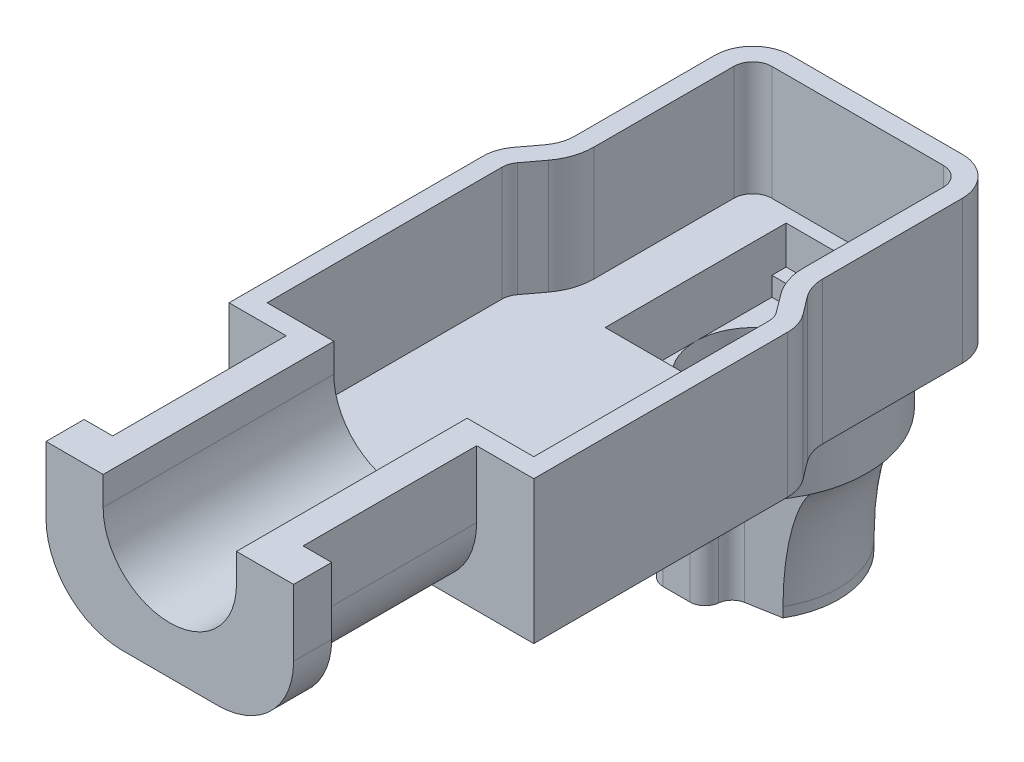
SolidWorks part; units mm, degrees
ref_plane "Front Plane" through (0, 0, 0) normal (0, 0, 1) x (1, 0, 0)
ref_plane "Top Plane" through (0, 0, 0) normal (0, 1, 0) x (1, 0, 0)
ref_plane "Right Plane" through (0, 0, 0) normal (1, 0, 0) x (0, 0, -1)
sketch "Sketch1" plane through (0, 0, 0) normal (0, 1, 0) x (-1, 0, 0)
  line L0 (-1.875, 8.0563) -> (-1.875, 12.7) construction
  line L1 (-1.875, 12.7) -> (1.875, 12.7) construction
  line L2 (1.875, 12.7) -> (1.875, 8.0563) construction
  line L3 (-6.25, 1.7379) -> (-6.25, -0.55) construction
  line L4 (6.25, 1.7379) -> (6.25, -0.55) construction
  line L5 (5, -1.8) -> (3.85, -1.8) construction
  line L6 (3.85, -1.8) -> (1.1627, -1.3232) construction
  line L7 (0.75, -0.8309) -> (0.75, -0.6) construction
  line L8 (0.75, -0.6) -> (-0.75, -0.6) construction
  line L9 (-0.75, -0.6) -> (-0.75, -0.8309) construction
  line L10 (-1.1627, -1.3232) -> (-3.85, -1.8) construction
  line L11 (-3.85, -1.8) -> (-5, -1.8) construction
  line L12 (0, -0.6) -> (0, -6.35) construction
  line L13 (-6.35, 0) -> (6.35, 0) construction
  line L14 (0, -6.35) -> (0, 12.7) construction
  arc A0 (6.25, 1.7379) -> (2.1991, 7.5882) centre (0, 1.7379) ccw construction
  arc A1 (-6.25, 1.7379) -> (-2.1991, 7.5882) centre (0, 1.7379) cw construction
  arc A4 (6.25, -0.55) -> (5, -1.8) centre (5, -0.55) cw construction
  arc A5 (-6.25, -0.55) -> (-5, -1.8) centre (-5, -0.55) ccw construction
  arc A6 (1.1627, -1.3232) -> (0.75, -0.8309) centre (1.25, -0.8309) cw construction
  arc A7 (-0.75, -0.8309) -> (-1.1627, -1.3232) centre (-1.25, -0.8309) cw construction
  arc A8 (1.875, 8.0563) -> (2.1991, 7.5882) centre (2.375, 8.0563) ccw construction
  arc A9 (-2.1991, 7.5882) -> (-1.875, 8.0563) centre (-2.375, 8.0563) ccw construction
  circle A10 centre (0, 0) radius 4.25 construction
  point P16 (0, -0.6)
  point P17 (0, 12.7)
  point P34 (0.75, -1.25)
  point P39 (1.875, 7.7)
  dimension "D9" = 1.25
  dimension "D10" = 1.1627
  dimension "D11" = 0.5
  dimension "D13" = 8.5
  dimension "D1" = 3.75
  dimension "D2" = 12.5
  dimension "D3" = 14.5
  dimension "D4" = 5.75
  dimension "D5" = 1.5
  dimension "D6" = 19.05
  dimension "D7" = 5
  dimension "D8" = 0.65
  dimension "D12" = 0.6
sketch "Sketch2" plane through (0, 0, 0) normal (0, 1, 0) x (1, 0, 0)
  line L0 (-0.75, 0.6) -> (0.75, 0.6)
  line L1 (0.75, 0.6) -> (0.75, 0.9147)
  line L2 (1.0801, 1.3086) -> (1.937, 1.4606)
  line L3 (-1.937, 1.4606) -> (-1.0801, 1.3086)
  line L4 (-0.75, 0.9147) -> (-0.75, 0.6)
  line L5 (1.1627, 1.3232) -> (3.85, 1.8) construction
  line L6 (-3.85, 1.8) -> (-1.1627, 1.3232) construction
  line L7 (2.0813, 2.2069) -> (-12840.1019, -8733.3974) construction
  line L8 (2.0783, 2.2049) -> (-12840.1049, -8733.3994) construction
  line L9 (1.7853, 2.0056) -> (-12840.3979, -8733.5987) construction
  line L10 (-4.8081, -2.6544) -> (12753.8291, 8676.1196) construction
  line L11 (0.8437, 1.3651) -> (0.925, 1.2455) construction
  line L12 (-1.593, 4.25) -> (1.593, 4.25) construction
  line L13 (0, 0.6) -> (0, 6.35) construction
  line L14 (-1.9625, 4.1053) -> (1.9625, 4.1053) construction
  line L15 (0, 4.25) -> (0, 4.1053) construction
  circle A1 centre (0, 2.6053) radius 1.5
  arc A2 (-1.0801, 1.3086) -> (-0.75, 0.9147) centre (-1.15, 0.9147) cw
  arc A3 (0.75, 0.9147) -> (1.0801, 1.3086) centre (1.15, 0.9147) cw
  arc A4 (-1.937, 1.4606) -> (1.937, 1.4606) centre (0, 2.6053) cw
  circle A5 centre (0, 0) radius 4.25 construction
  point P26 (-0.75, 1.25)
  dimension "D1" = 3
  dimension "D2" = 0.4
  dimension "D3" = 2.25
extrude "Boss-Extrude1" add sketch "Sketch2" along normal blind 3.25
sketch "Sketch4" plane through (0, 3.25, 0) normal (0, 1, 0) x (1, 0, 0)
  line L1 (-1.5, 0.6053) -> (1.5, 0.6053) construction
  line L2 (-1.5, 0.6053) -> (-1.5, 4.6053) construction
  line L3 (-1.5, 4.6053) -> (1.5, 4.6053) construction
  line L4 (1.5, 0.6053) -> (1.5, 4.6053) construction
  line L5 (-1.5, 0.6053) -> (1.5, 4.6053) construction
  line L6 (-1.5, 4.6053) -> (1.5, 0.6053) construction
  circle A0 centre (0, 2.6053) radius 1.5
  circle A1 centre (0, 2.6053) radius 3
  circle A2 centre (0, 2.6053) radius 1.5 construction
  dimension "D1" = 6
  dimension "D2" = 3
  dimension "D3" = 4
extrude "Boss-Extrude2" add sketch "Sketch4" along normal blind 0.75
sketch "Sketch3" plane through (0, 4, 0) normal (0, 1, 0) x (1, 0, 0)
  line L0 (1.5, 4.6053) -> (-1.5, 0.6053) construction
  line L1 (-1.5, 0.6053) -> (1.5, 0.6053)
  line L2 (-1.5, 0.6053) -> (-1.5, 4.6053)
  line L3 (-1.5, 4.6053) -> (1.5, 4.6053)
  line L4 (1.5, 0.6053) -> (1.5, 4.6053)
  line L5 (-1.5, 4.6053) -> (1.5, 0.6053) construction
  circle A1 centre (0, 2.6053) radius 3
  circle A2 centre (0, 2.6053) radius 3 construction
  point P4 (0, 2.6053)
  dimension "D1" = 4
  dimension "D2" = 3
extrude "Boss-Extrude3" add sketch "Sketch3" along normal blind 1.5
sketch "Sketch5" plane through (0, 5.5, 0) normal (0, 1, 0) x (1, 0, 0)
  line L0 (1.5, 0.6053) -> (1.5, 4.6053) construction
  line L1 (-1.5, 0.2303) -> (1.5, 0.2303)
  line L2 (-1.5, 0.2303) -> (-1.5, 4.9803)
  line L3 (-1.5, 4.9803) -> (1.5, 4.9803)
  line L4 (1.5, 0.2303) -> (1.5, 4.9803)
  line L5 (-1.5, 0.2303) -> (1.5, 4.9803) construction
  line L6 (-1.5, 4.9803) -> (1.5, 0.2303) construction
  point P0 (0, 2.6053)
  dimension "D1" = 4.75
extrude "Cut-Extrude1" cut sketch "Sketch5" against normal offset from surface (1 mm away) 0.5
sketch "Sketch6" plane through (0, 5.5, 0) normal (0, 1, 0) x (1, 0, 0)
  line L0 (-3.25, 5.8553) -> (3.25, 5.8553)
  line L1 (3.25, 5.8553) -> (3.25, 0.8553)
  line L2 (3.25, 0.8553) -> (4, -0.1447)
  line L3 (4, -0.1447) -> (4, -6.6447)
  line L4 (4, -6.6447) -> (-4, -6.6447)
  line L5 (-4, -6.6447) -> (-4, -0.1447)
  line L6 (-4, -0.1447) -> (-3.25, 0.8553)
  line L7 (-3.25, 0.8553) -> (-3.25, 5.8553)
  line L8 (-3.25, 0.8553) -> (3.25, 0.8553) construction
  line L9 (-4, -0.1447) -> (4, -0.1447) construction
  line L10 (0, 5.8553) -> (0, -6.6447) construction
  line L11 (0, 0.6) -> (0, 6.35) construction
  line L12 (-3.25, 2.6053) -> (3.25, 2.6053) construction
  circle A0 centre (0, 2.6053) radius 3 construction
  circle A1 centre (0, 2.6053) radius 3
  point P13 (0, 0.8553)
  point P15 (0, -0.1447)
  dimension "D1" = 8
  dimension "D2" = 6.5
  dimension "D3" = 5
  dimension "D4" = 6.5
  dimension "D5" = 1
  dimension "D6" = 3.25
extrude "Boss-Extrude5" add sketch "Sketch6" against normal blind 0.75
fillet "Fillet1" radius 1 6 edges at (4, 5.125, 0.1447) (3.25, 5.125, -0.8553) (-4, 5.125, 0.1447) (-3.25, 5.125, -0.8553) (3.25, 5.125, -5.8553) (-3.25, 5.125, -5.8553)
sketch "Sketch7" plane through (0, 5.5, 0) normal (0, 1, 0) x (1, 0, 0)
  line L52 (-4, -6.6447) -> (-4, -0.478)
  line L53 (-3.8, 0.122) -> (-3.45, 0.5887)
  line L54 (-3.25, 1.1887) -> (-3.25, 4.8553)
  line L55 (-2.25, 5.8553) -> (2.25, 5.8553)
  line L56 (3.25, 4.8553) -> (3.25, 1.1887)
  line L57 (3.45, 0.5887) -> (3.8, 0.122)
  line L58 (4, -0.478) -> (4, -6.6447)
  line L59 (2.75, 1.1887) -> (2.75, 4.8553)
  line L60 (3.4, -0.178) -> (3.05, 0.2887)
  line L61 (3.5, -6.6447) -> (3.5, -0.478)
  line L62 (-3.5, -0.478) -> (-3.5, -6.6447)
  line L63 (-3.05, 0.2887) -> (-3.4, -0.178)
  line L64 (-2.75, 4.8553) -> (-2.75, 1.1887)
  line L65 (2.25, 5.3553) -> (-2.25, 5.3553)
  line L66 (2.75, 1.1887) -> (2.75, 4.8553)
  line L67 (3.4, -0.178) -> (3.05, 0.2887)
  line L68 (3.5, -6.6447) -> (3.5, -0.478)
  line L69 (-3.5, -0.478) -> (-3.5, -6.6447)
  line L70 (-3.05, 0.2887) -> (-3.4, -0.178)
  line L71 (-2.75, 4.8553) -> (-2.75, 1.1887)
  line L72 (2.25, 5.3553) -> (-2.25, 5.3553)
  line L73 (4, -6.6447) -> (3.5, -6.6447)
  line L74 (-4, -6.6447) -> (-3.5, -6.6447)
  line L75 (3.8, 0.122) -> (3.45, 0.5887) construction
  line L76 (3.25, 1.1887) -> (3.25, 4.8553) construction
  line L77 (2.25, 5.8553) -> (-2.25, 5.8553) construction
  line L78 (-3.25, 4.8553) -> (-3.25, 1.1887) construction
  line L79 (-3.45, 0.5887) -> (-3.8, 0.122) construction
  arc A39 (3.8, 0.122) -> (4, -0.478) centre (3, -0.478) cw
  arc A40 (3.25, 1.1887) -> (3.45, 0.5887) centre (4.25, 1.1887) ccw
  arc A41 (2.25, 5.8553) -> (3.25, 4.8553) centre (2.25, 4.8553) cw
  arc A42 (-3.25, 4.8553) -> (-2.25, 5.8553) centre (-2.25, 4.8553) cw
  arc A43 (-3.45, 0.5887) -> (-3.25, 1.1887) centre (-4.25, 1.1887) ccw
  arc A44 (-4, -0.478) -> (-3.8, 0.122) centre (-3, -0.478) cw
  arc A45 (2.75, 4.8553) -> (2.25, 5.3553) centre (2.25, 4.8553) ccw
  arc A46 (2.75, 1.1887) -> (3.05, 0.2887) centre (4.25, 1.1887) ccw
  arc A47 (3.5, -0.478) -> (3.4, -0.178) centre (3, -0.478) ccw
  arc A48 (-3.4, -0.178) -> (-3.5, -0.478) centre (-3, -0.478) ccw
  arc A49 (-3.05, 0.2887) -> (-2.75, 1.1887) centre (-4.25, 1.1887) ccw
  arc A50 (-2.25, 5.3553) -> (-2.75, 4.8553) centre (-2.25, 4.8553) ccw
  arc A51 (2.75, 4.8553) -> (2.25, 5.3553) centre (2.25, 4.8553) ccw
  arc A52 (2.75, 1.1887) -> (3.05, 0.2887) centre (4.25, 1.1887) ccw
  arc A53 (3.5, -0.478) -> (3.4, -0.178) centre (3, -0.478) ccw
  arc A54 (-3.4, -0.178) -> (-3.5, -0.478) centre (-3, -0.478) ccw
  arc A55 (-3.05, 0.2887) -> (-2.75, 1.1887) centre (-4.25, 1.1887) ccw
  arc A56 (-2.25, 5.3553) -> (-2.75, 4.8553) centre (-2.25, 4.8553) ccw
  dimension "D2" = 1
  dimension "D1" = 0.5
extrude "Boss-Extrude6" add sketch "Sketch7" along normal blind 2
sketch "Sketch8" plane through (0, 4.75, 0) normal (0, -1, 0) x (1, 0, 0)
  line L6 (-4, 6.6447) -> (-4, 7.1447)
  line L7 (-4, 7.1447) -> (-2.5, 7.1447)
  line L11 (2.5, 7.1447) -> (4, 7.1447)
  line L12 (4, 7.1447) -> (4, 6.6447)
  line L13 (4, 6.6447) -> (-4, 6.6447)
  line L17 (-2.5, 7.1447) -> (-2.5, 11.7)
  line L18 (-2.5, 11.7) -> (-3.25, 11.7)
  line L19 (-3.25, 11.7) -> (-3.25, 12.7)
  line L20 (-3.25, 12.7) -> (3.25, 12.7)
  line L21 (3.25, 12.7) -> (3.25, 11.7)
  line L22 (2.5, 7.1447) -> (2.5, 11.7)
  line L23 (2.5, 11.7) -> (3.25, 11.7)
  line L24 (1.875, 12.7) -> (-1.875, 12.7) construction
  dimension "D1" = 5
  dimension "D2" = 0.5
  dimension "D3" = 1
  dimension "D4" = 6.5
extrude "Boss-Extrude7" add sketch "Sketch8" against normal up to surface (2.75 mm away)
sketch "Sketch9" plane through (0, 7.5, 0) normal (0, 1, 0) x (1, 0, 0)
  line L0 (-3.5, -6.6447) -> (3.5, -6.6447) construction
  line L1 (-2, -6.6447) -> (2, -6.6447)
  line L2 (-2, -6.6447) -> (-2, -12.7)
  line L3 (-2, -12.7) -> (2, -12.7)
  line L4 (2, -6.6447) -> (2, -12.7)
  line L5 (3.25, -12.7) -> (-3.25, -12.7) construction
  line L6 (0, 6.35) -> (0, -12.7) construction
  line L7 (-2.5, -11.7) -> (-2.5, -7.1447) construction
  point P8 (0, -6.6447)
  dimension "D1" = 0.5
extrude "Cut-Extrude2" cut sketch "Sketch9" against normal up to surface (2 mm away)
sketch "Sketch10" plane through (0, 7.5, 0) normal (0, 1, 0) x (1, 0, 0)
  line L0 (-4, -0.478) -> (-4, -7.1447)
  line L1 (-4, -7.1447) -> (-2.5, -7.1447)
  line L2 (-2.5, -7.1447) -> (-2.5, -11.7)
  line L3 (-2.5, -11.7) -> (-3.25, -11.7)
  line L4 (-3.25, -11.7) -> (-3.25, -12.7)
  line L5 (-3.25, -12.7) -> (-2, -12.7)
  line L6 (-2, -12.7) -> (-2, -6.6447)
  line L7 (-2, -6.6447) -> (-3.5, -6.6447)
  line L8 (-3.5, -6.6447) -> (-3.5, -0.478)
  line L9 (-3.4, -0.178) -> (-3.05, 0.2887)
  line L10 (-2.75, 1.1887) -> (-2.75, 4.8553)
  line L11 (-2.25, 5.3553) -> (2.25, 5.3553)
  line L12 (2.75, 4.8553) -> (2.75, 1.1887)
  line L13 (3.05, 0.2887) -> (3.4, -0.178)
  line L14 (3.5, -0.478) -> (3.5, -6.6447)
  line L15 (3.5, -6.6447) -> (2, -6.6447)
  line L16 (2, -6.6447) -> (2, -12.7)
  line L17 (2, -12.7) -> (3.25, -12.7)
  line L18 (3.25, -12.7) -> (3.25, -11.7)
  line L19 (3.25, -11.7) -> (2.5, -11.7)
  line L20 (2.5, -11.7) -> (2.5, -7.1447)
  line L21 (2.5, -7.1447) -> (4, -7.1447)
  line L22 (4, -7.1447) -> (4, -0.478)
  line L23 (3.8, 0.122) -> (3.45, 0.5887)
  line L24 (3.25, 1.1887) -> (3.25, 4.8553)
  line L25 (2.25, 5.8553) -> (-2.25, 5.8553)
  line L26 (2.25, 5.8553) -> (-2.25, 5.8553) construction
  line L27 (-3.25, 4.8553) -> (-3.25, 1.1887)
  line L28 (-3.45, 0.5887) -> (-3.8, 0.122)
  arc A0 (-3.5, -0.478) -> (-3.4, -0.178) centre (-3, -0.478) cw
  arc A1 (-3.05, 0.2887) -> (-2.75, 1.1887) centre (-4.25, 1.1887) ccw
  arc A2 (-2.75, 4.8553) -> (-2.25, 5.3553) centre (-2.25, 4.8553) cw
  arc A3 (2.25, 5.3553) -> (2.75, 4.8553) centre (2.25, 4.8553) cw
  arc A4 (2.75, 1.1887) -> (3.05, 0.2887) centre (4.25, 1.1887) ccw
  arc A5 (3.4, -0.178) -> (3.5, -0.478) centre (3, -0.478) cw
  arc A6 (4, -0.478) -> (3.8, 0.122) centre (3, -0.478) ccw
  arc A7 (3.45, 0.5887) -> (3.25, 1.1887) centre (4.25, 1.1887) cw
  arc A8 (3.25, 4.8553) -> (2.25, 5.8553) centre (2.25, 4.8553) ccw
  arc A9 (-2.25, 5.8553) -> (-3.25, 4.8553) centre (-2.25, 4.8553) ccw construction
  arc A10 (-2.25, 5.8553) -> (-3.25, 4.8553) centre (-2.25, 4.8553) ccw
  arc A11 (-3.25, 1.1887) -> (-3.45, 0.5887) centre (-4.25, 1.1887) cw
  arc A12 (-3.8, 0.122) -> (-4, -0.478) centre (-3, -0.478) ccw
extrude "Boss-Extrude8" add sketch "Sketch10" along normal blind 1
sketch "Sketch12" plane through (0, 0, 12.7) normal (0, 0, 1) x (1, 0, 0)
  line L0 (0, 4.75) -> (0, 50004.75) construction
  line L1 (3.25, 4.75) -> (-3.25, 4.75) construction
  line L2 (2, 5.5) -> (-2, 5.5) construction
  line L3 (0, 5.5) -> (0, 6) construction
  line L5 (-2, 5.5) -> (2, 5.5)
  line L8 (-1.75, 7.75) -> (-1.75, 8.5)
  line L9 (-1.75, 8.5) -> (-2, 8.5)
  line L10 (-2, 8.5) -> (-2, 5.5)
  line L11 (2, 5.5) -> (2, 8.5)
  line L12 (2, 8.5) -> (1.75, 8.5)
  line L13 (1.75, 8.5) -> (1.75, 7.75)
  arc A0 (-1.75, 7.75) -> (1.75, 7.75) centre (0, 7.75) ccw
  point P7 (0, 4.75)
  point P10 (0, 5.5)
  dimension "D2" = 1.75
  dimension "D1" = 0.5
extrude "Boss-Extrude9" add sketch "Sketch12" against normal up to surface (6.0553 mm away)
chamfer "Chamfer1" [suppressed] distance 2 angle 45
chamfer "Chamfer2" [suppressed] distance 2 angle 45
fillet "Fillet3" radius 2 2 edges at (2.5, 4.75, 9.4223) (-2.5, 4.75, 9.4223)
fillet "Fillet4" radius 2 2 edges at (-3.25, 4.75, 12.2) (3.25, 4.75, 12.2)
fillet "Fillet2" radius 0.4 2 edges at (0.75, 1.625, -0.6) (-0.75, 1.625, -0.6)
fillet "Fillet5" radius 3 1 edges at (0, 3.25, -4.8553)
